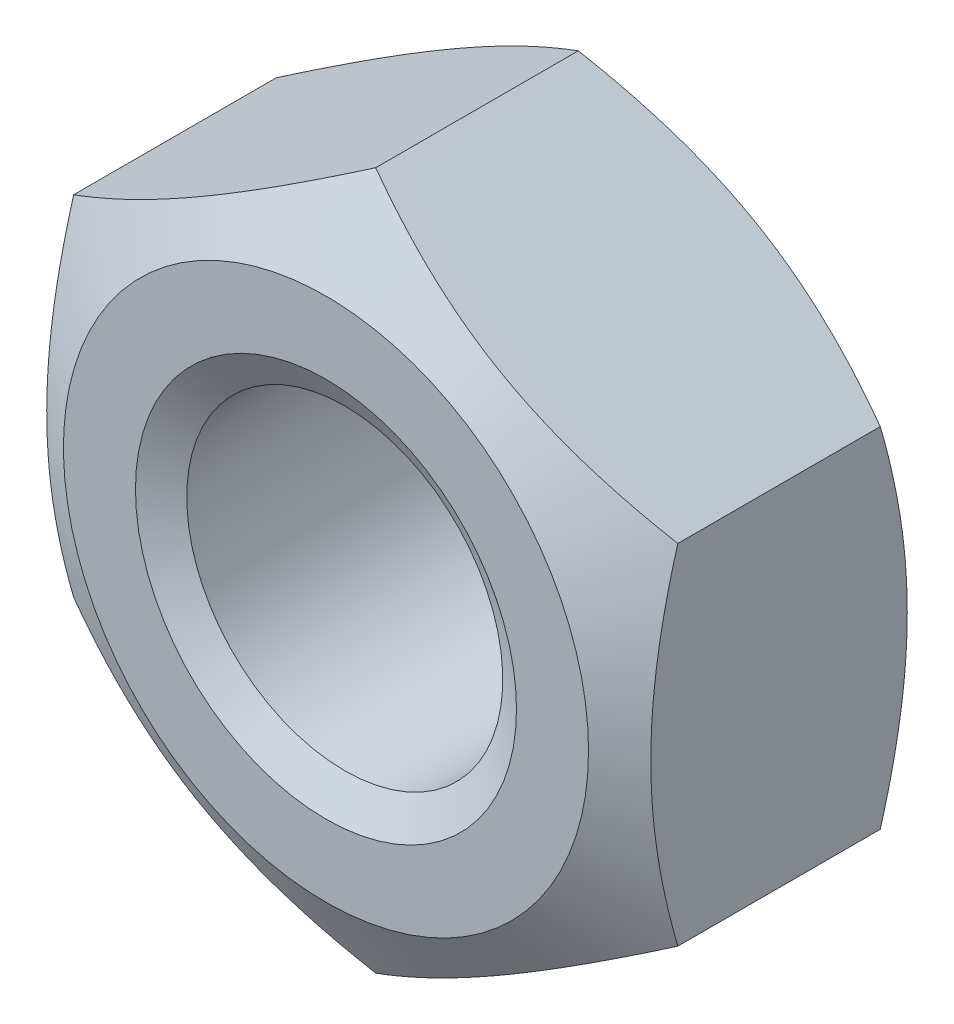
SolidWorks part; units mm, degrees
ref_plane "Front Plane" through (0, 0, 0) normal (0, 0, 1) x (1, 0, 0)
ref_plane "Top Plane" through (0, 0, 0) normal (0, 1, 0) x (1, 0, 0)
ref_plane "Right Plane" through (0, 0, 0) normal (1, 0, 0) x (0, 0, -1)
sketch "Sketch1" plane through (0, 0, 0) normal (0, 0, 1) x (1, 0, 0)
  line L0 (0, 0) -> (0, 7.5056) construction
  line L1 (0, 7.5056) -> (-6.5, 3.7528)
  line L2 (-6.5, 3.7528) -> (-6.5, -3.7528)
  line L3 (-6.5, -3.7528) -> (0, -7.5056)
  line L4 (0, -7.5056) -> (6.5, -3.7528)
  line L5 (6.5, -3.7528) -> (6.5, 3.7528)
  line L6 (6.5, 3.7528) -> (0, 7.5056)
  circle A0 centre (0, 0) radius 6.5 construction
  dimension "S DIM" = 13
extrude "Boss-Extrude1" add sketch "Sketch1" against normal blind 6.5
sketch "Sketch4" plane through (0, 0, 0) normal (1, 0, 0) x (0, 0, -1)
  line L0 (6.5, 7.5056) -> (5.4287, 7.5056)
  line L1 (6.5, 7.5056) -> (0, 7.5056) construction
  line L2 (5.4287, 7.5056) -> (6.5, 5.65)
  line L4 (6.5, 5.65) -> (6.5, 7.5056)
  line L5 (0, 0) -> (3.2979, 0) construction
  line L6 (0, 7.5056) -> (1.0713, 7.5056)
  line L7 (1.0713, 7.5056) -> (0, 5.65)
  line L9 (0, 5.65) -> (0, 7.5056)
  dimension "SAME S 1" = 11.3
  dimension "D2" = 30
  dimension "SAME S 2" = 11.3
  dimension "D4" = 30
revolve "Cut-Revolve1" cut sketch "Sketch4" angle 360 about L5
sketch "Sketch5" plane through (0, 0, 0) normal (1, 0, 0) x (0, 0, -1)
  line L0 (0, 0) -> (6.5, 0) construction
  line L1 (0, 0) -> (0, 4.1)
  line L2 (0, 5.65) -> (0, -5.65) construction
  line L3 (0, 4.1) -> (0.4041, 3.4)
  line L4 (0.4041, 3.4) -> (6.0959, 3.4)
  line L5 (6.0959, 3.4) -> (6.5, 4.1)
  line L6 (6.5, 4.1) -> (6.5, 0)
  line L8 (6.5, -5.65) -> (6.5, 5.65) construction
  line L9 (6.5, 0) -> (0, 0)
  dimension "D1" = 60
  dimension "D2" = 60
  dimension "Hole2" = 8.2
  dimension "Hole1" = 6.8
revolve "Cut-Revolve2" cut sketch "Sketch5" angle 360 about L0
